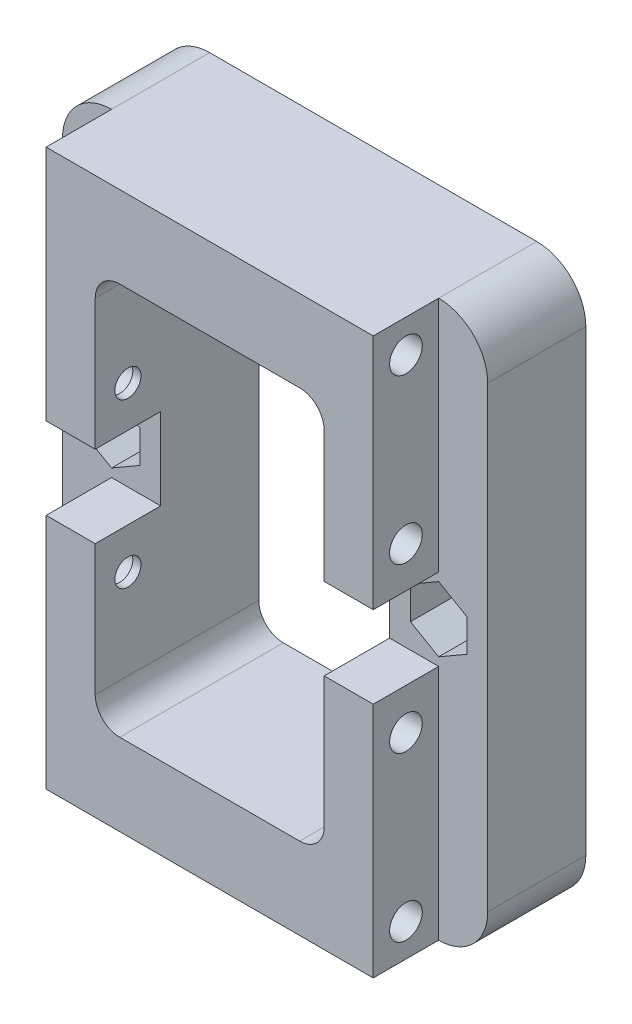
SolidWorks part; units mm, degrees
ref_plane "前视基准面" through (0, 0, 0) normal (0, 0, 1) x (1, 0, 0)
ref_plane "上视基准面" through (0, 0, 0) normal (0, 1, 0) x (1, 0, 0)
ref_plane "右视基准面" through (0, 0, 0) normal (1, 0, 0) x (0, 0, -1)
other "Configuration Table"
sketch "草图1" plane through (0, 0, 0) normal (0, 0, 1) x (1, 0, 0)
  line L1 (-11, 24) -> (11, 24)
  line L2 (-14, 21) -> (-14, -21)
  line L3 (-11, -24) -> (11, -24)
  line L4 (14, 21) -> (14, -21)
  line L5 (-26, -34) -> (26, -34)
  line L6 (-26, -34) -> (-26, 34)
  line L7 (-26, 34) -> (26, 34)
  line L8 (26, -34) -> (26, 34)
  line L9 (-26, -34) -> (26, 34) construction
  line L10 (-26, 34) -> (26, -34) construction
  arc A0 (-14, -21) -> (-11, -24) centre (-11, -21) ccw
  arc A1 (11, -24) -> (14, -21) centre (11, -21) ccw
  arc A2 (11, 24) -> (14, 21) centre (11, 21) cw
  arc A3 (-11, 24) -> (-14, 21) centre (-11, 21) ccw
  circle A4 centre (-20, 0) radius 2.1
  circle A5 centre (20, 0) radius 2.1
  point P4 (14, 0)
  point P6 (0, -24)
  point P9 (-14, -24)
  point P12 (14, -24)
  point P15 (14, 24)
  point P18 (0, 0)
  point P27 (0, 0)
  dimension "D3" = 3
  dimension "D8" = 4.2
  dimension "D1" = 28
  dimension "D2" = 48
  dimension "D4" = 6
  dimension "D5" = 68
  dimension "D6" = 20
  dimension "D7" = 20
extrude "凸台-拉伸1" add sketch "草图1" against normal blind 12
sketch "草图2" plane through (0, 0, 0) normal (0, 0, 1) x (1, 0, 0)
  line L1 (-20, 3.9837) -> (-23.45, 1.9919)
  line L2 (-23.45, 1.9919) -> (-23.45, -1.9919)
  line L3 (-23.45, -1.9919) -> (-20, -3.9837)
  line L4 (-20, -3.9837) -> (-16.55, -1.9919)
  line L5 (-16.55, -1.9919) -> (-16.55, 1.9919)
  line L6 (-16.55, 1.9919) -> (-20, 3.9837)
  line L7 (20, 3.9837) -> (16.55, 1.9919)
  line L8 (16.55, 1.9919) -> (16.55, -1.9919)
  line L9 (16.55, -1.9919) -> (20, -3.9837)
  line L10 (20, -3.9837) -> (23.45, -1.9919)
  line L11 (23.45, -1.9919) -> (23.45, 1.9919)
  line L12 (23.45, 1.9919) -> (20, 3.9837)
  circle A0 centre (-20, 0) radius 3.45 construction
  circle A1 centre (20, 0) radius 3.45 construction
  dimension "D1" = 6.9
extrude "切除-拉伸1" cut sketch "草图2" against normal blind 6.9
sketch "草图3" plane through (0, 0, 0) normal (0, 0, 1) x (1, 0, 0)
  line L0 (-14, 21) -> (-14, -21) construction
  line L1 (-14, 5) -> (-20, 5)
  line L4 (-20, 5) -> (-20, 34)
  line L5 (14, -21) -> (14, 21) construction
  line L6 (14, 5) -> (20, 5)
  line L8 (-20, 34) -> (20, 34)
  line L9 (20, 5) -> (20, 34)
  line L10 (-20, 0) -> (20, 0) construction
  line L11 (20, -5) -> (20, -34)
  line L14 (14, -5) -> (20, -5)
  line L15 (-20, -5) -> (-20, -34)
  line L18 (-14, -5) -> (-20, -5)
  line L19 (-20, -34) -> (20, -34)
  line L20 (-11, -24) -> (11, -24) construction
  line L21 (11, 24) -> (-11, 24) construction
  line L22 (-11, -24) -> (11, -24)
  line L23 (11, 24) -> (-11, 24)
  line L24 (-14, 21) -> (-14, 5)
  line L25 (14, 21) -> (14, 5)
  line L26 (14, -5) -> (14, -21)
  line L27 (-14, -21) -> (-14, -5)
  line L28 (26, 34) -> (-26, 34) construction
  arc A0 (11, -24) -> (14, -21) centre (11, -21) ccw construction
  arc A1 (-14, -21) -> (-11, -24) centre (-11, -21) ccw construction
  arc A2 (14, 21) -> (11, 24) centre (11, 21) ccw construction
  arc A3 (-11, 24) -> (-14, 21) centre (-11, 21) ccw construction
  arc A4 (11, -24) -> (14, -21) centre (11, -21) ccw
  arc A5 (-14, -21) -> (-11, -24) centre (-11, -21) ccw
  arc A6 (14, 21) -> (11, 24) centre (11, 21) ccw
  arc A7 (-11, 24) -> (-14, 21) centre (-11, 21) ccw
  point P31 (-20, 35)
  dimension "D1" = 40
  dimension "D2" = 20
  dimension "D3" = 10
extrude "凸台-拉伸2" add sketch "草图3" along normal blind 8
sketch "草图4" plane through (-20, 0, 0) normal (-1, 0, 0) x (0, 0, 1)
  line L0 (4, -30) -> (4, -10) construction
  line L2 (0, 34) -> (0, -34) construction
  circle A0 centre (4, -30) radius 1.6
  circle A1 centre (4, -10) radius 1.6
  circle A2 centre (4, 10) radius 1.6
  circle A3 centre (4, 30) radius 1.6
  point P13 (3.2329, -10.3896)
  dimension "D3" = 3.2
  dimension "D2" = 20
  dimension "D4" = 10
  dimension "D5" = 4
  dimension "D1" = 4
extrude "切除-拉伸2" cut sketch "草图4" against normal through all
sketch "草图5" plane through (-20, 0, 0) normal (-1, 0, 0) x (0, 0, 1)
  line L0 (4, -30) -> (4, -10) construction
  circle A0 centre (4, -30) radius 2
  circle A1 centre (4, -10) radius 2
  circle A2 centre (4, 10) radius 2
  circle A3 centre (4, 30) radius 2
  dimension "D1" = 4
  dimension "D2" = 4
  dimension "D3" = 20
extrude "切除-拉伸3" cut sketch "草图5" against normal blind 5
sketch "草图6" plane through (20, 0, 0) normal (1, 0, 0) x (0, 0, -1)
  line L0 (-4, -30) -> (-4, -10) construction
  circle A0 centre (-4, -30) radius 2
  circle A1 centre (-4, -10) radius 2
  circle A2 centre (-4, 10) radius 2
  circle A3 centre (-4, 30) radius 2
  dimension "D1" = 4
  dimension "D2" = 4
  dimension "D3" = 20
extrude "切除-拉伸4" cut sketch "草图6" against normal blind 5
fillet "圆角1" radius 6 4 edges at (26, 34, -6) (-26, 34, -6) (-26, -34, -6) (26, -34, -6)
